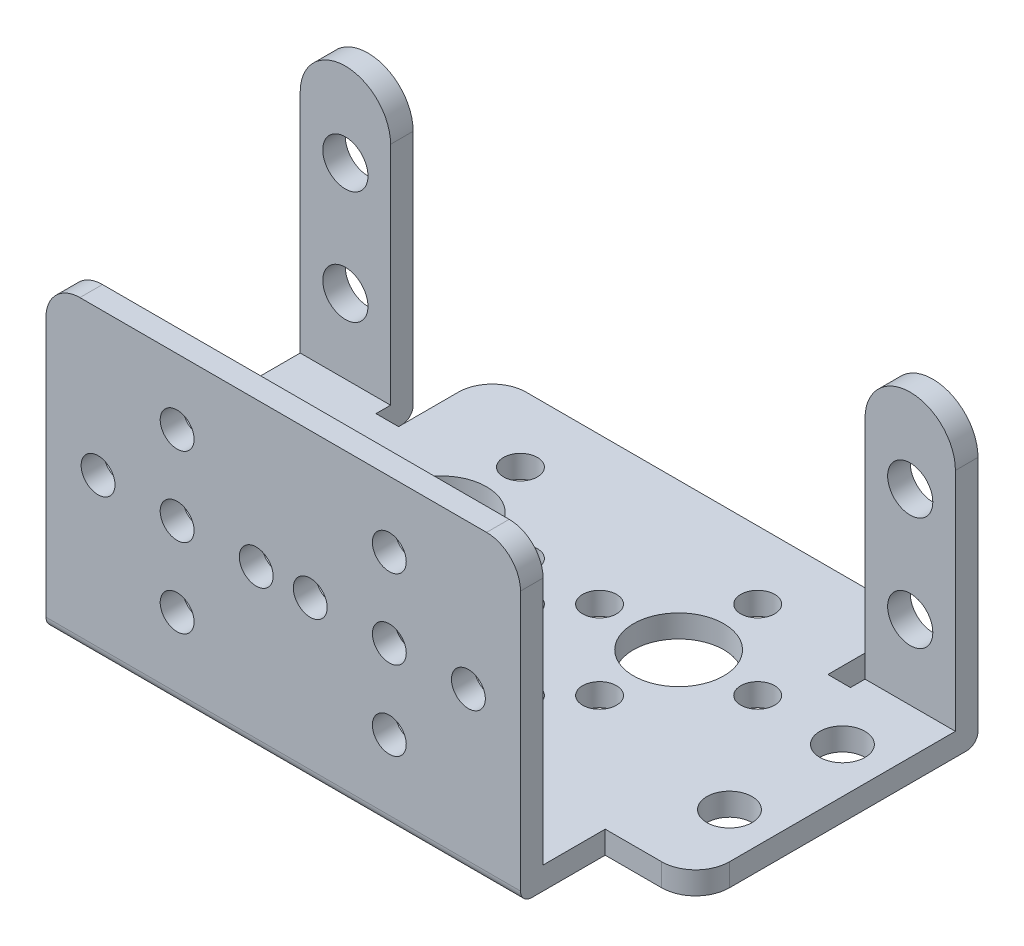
SolidWorks part; units mm, degrees
ref_plane "Front Plane" through (0, 0, 0) normal (0, 0, 1) x (1, 0, 0)
ref_plane "Top Plane" through (0, 0, 0) normal (0, 1, 0) x (1, 0, 0)
ref_plane "Right Plane" through (0, 0, 0) normal (1, 0, 0) x (0, 0, -1)
sketch "Sketch1" plane through (0, 0, 0) normal (0, 1, 0) x (1, 0, 0)
  line L0 (0, 0) -> (0, 35.8825) construction
  line L1 (21, 0) -> (-21, 0)
  line L2 (-21, 0) -> (-21, 7.5)
  line L3 (-21, 7.5) -> (-26, 7.5)
  line L4 (-29, 10.5) -> (-29, 32.5)
  line L5 (-29, 32.5) -> (-21, 32.5)
  line L6 (-21, 32.5) -> (-21, 29.2093)
  line L7 (-21, 29.2093) -> (-19, 29.2093)
  line L8 (-19, 29.2093) -> (-19, 34.5)
  line L9 (-16, 37.5) -> (16, 37.5)
  line L10 (21, 0) -> (21, 7.5)
  line L11 (21, 7.5) -> (26, 7.5)
  line L12 (19, 29.2093) -> (19, 34.5)
  line L13 (21, 29.2093) -> (19, 29.2093)
  line L14 (21, 32.5) -> (21, 29.2093)
  line L15 (29, 32.5) -> (21, 32.5)
  line L16 (29, 10.5) -> (29, 32.5)
  circle A0 centre (-25, 24.5) radius 2
  circle A1 centre (-25, 14.5) radius 2
  circle A2 centre (25, 14.5) radius 2
  circle A3 centre (25, 24.5) radius 2
  arc A4 (19, 34.5) -> (16, 37.5) centre (16, 34.5) ccw
  arc A5 (26, 7.5) -> (29, 10.5) centre (26, 10.5) ccw
  arc A6 (-19, 34.5) -> (-16, 37.5) centre (-16, 34.5) cw
  arc A7 (-26, 7.5) -> (-29, 10.5) centre (-26, 10.5) cw
  circle A8 centre (0, 14) radius 7 construction
  circle A9 centre (0, 14) radius 4
  circle A10 centre (0, 21) radius 1.5
  circle A11 centre (7, 14) radius 1.5
  circle A12 centre (0, 7) radius 1.5
  circle A13 centre (-7, 14) radius 1.5
  circle A14 centre (10.5, 24.5) radius 7 construction
  circle A15 centre (10.5, 24.5) radius 4
  circle A16 centre (10.5, 31.5) radius 1.5
  circle A20 centre (-10.5, 24.5) radius 7 construction
  circle A21 centre (-10.5, 24.5) radius 4
  circle A22 centre (-10.5, 31.5) radius 1.5
  circle A26 centre (3.5, 24.5) radius 1.5
  circle A27 centre (10.5, 17.5) radius 1.5
  circle A28 centre (17.5, 24.5) radius 1.5
  circle A29 centre (-3.5, 24.5) radius 1.5
  circle A30 centre (-10.5, 17.5) radius 1.5
  circle A31 centre (-17.5, 24.5) radius 1.5
  point P13 (0, 37.5)
  point P30 (19, 37.5)
  point P33 (29, 7.5)
  point P36 (-19, 37.5)
  point P39 (-29, 7.5)
  point P56 (4.5151, 24.5)
  point P57 (0, 5.0321)
  point P58 (-7, 14)
  point P76 (-17.5, 24.5)
  point P77 (0, 0)
  dimension "D6" = 4
  dimension "D7" = 4
  dimension "D8" = 10
  dimension "D9" = 14.5
  dimension "D11" = 3
  dimension "D12" = 14
  dimension "D13" = 8
  dimension "D14" = 3
  dimension "D16" = 14
  dimension "D17" = 8
  dimension "D18" = 3
  dimension "D19" = 14
  dimension "D20" = 8
  dimension "D21" = 3
  dimension "D24" = 21
  dimension "D26" = 14
  dimension "D1" = 38
  dimension "D2" = 58
  dimension "D3" = 37.5
  dimension "D4" = 32.5
  dimension "D5" = 2
  dimension "D10" = 7.5
  dimension "D25" = 10.5
  dimension "D15" = 4
  dimension "D22" = 4
  dimension "D23" = 4
extrude "Boss-Extrude1" add sketch "Sketch1" along normal blind 27
sketch "Sketch3" plane through (0, 0, 0) normal (1, 0, 0) x (0, 0, -1)
  line L0 (0, 27) -> (0, 0) construction
  line L1 (2, 28.5272) -> (30.5, 28.5272)
  line L2 (2, 28.5272) -> (2, 2)
  line L3 (2, 2) -> (30.5, 2)
  line L4 (30.5, 28.5272) -> (30.5, 2)
  line L5 (0, 0) -> (7.5, 0) construction
  line L7 (32.557, 2) -> (38.8255, 2)
  line L8 (32.557, 2) -> (32.557, 28.5272)
  line L9 (32.557, 28.5272) -> (38.8255, 28.5272)
  line L10 (38.8255, 2) -> (38.8255, 28.5272)
  dimension "D1" = 28.5
  dimension "D2" = 2
  dimension "D3" = 2
extrude "Cut-Extrude1" cut sketch "Sketch3" against normal through all both and the other way through all
sketch "Sketch4" plane through (0, 0, 0) normal (0, 0, 1) x (1, 0, 0)
  line L0 (-21, 27) -> (-21, 2) construction
  line L1 (-29, 0) -> (-21, 0) construction
  line L2 (-29, 0) -> (-29, 26) construction
  line L3 (-29, 26) -> (-21, 26) construction
  line L4 (-21, 0) -> (-21, 26) construction
  line L5 (0, 0) -> (0, 14.6606) construction
  line L6 (29, 0) -> (21, 0) construction
  line L7 (21, 0) -> (21, 26) construction
  line L8 (29, 0) -> (29, 26) construction
  line L9 (29, 26) -> (21, 26) construction
  line L10 (-29, 22) -> (-29, 28.588)
  line L11 (-29, 28.588) -> (-21, 28.588)
  line L12 (-21, 28.588) -> (-21, 22)
  line L14 (29, 26) -> (21, 26) construction
  line L16 (21, 28.588) -> (21, 22)
  line L17 (29, 28.588) -> (21, 28.588)
  line L18 (29, 22) -> (29, 28.588)
  arc A0 (-21, 22) -> (-29, 22) centre (-25, 22) ccw
  arc A1 (21, 22) -> (29, 22) centre (25, 22) cw
  circle A2 centre (-25, 18.5734) radius 2
  circle A3 centre (-25, 8.5734) radius 2
  circle A4 centre (-9.3912, 14.1874) radius 7 construction
  circle A5 centre (-9.3912, 14.1874) radius 4 construction
  circle A6 centre (-9.3912, 21.1874) radius 1.5
  circle A7 centre (-2.3912, 14.1874) radius 1.5
  circle A8 centre (-9.3912, 7.1874) radius 1.5
  circle A9 centre (-16.3912, 14.1874) radius 1.5
  circle A10 centre (2.3912, 14.1874) radius 1.5
  circle A11 centre (9.3912, 14.1874) radius 7 construction
  circle A12 centre (16.3912, 14.1874) radius 1.5
  circle A13 centre (9.3912, 7.1874) radius 1.5
  circle A14 centre (9.3912, 21.1874) radius 1.5
  circle A15 centre (9.3912, 14.1874) radius 4 construction
  circle A16 centre (25, 8.5734) radius 2
  circle A17 centre (25, 18.5734) radius 2
  circle A18 centre (-9.3912, 14.1874) radius 1.5
  circle A19 centre (9.3912, 14.1874) radius 1.5
  dimension "D2" = 4
  dimension "D3" = 4
  dimension "D4" = 10
  dimension "D5" = 14
  dimension "D6" = 4
  dimension "D7" = 3
  dimension "D8" = 3
  dimension "D1" = 26
extrude "Cut-Extrude2" cut sketch "Sketch4" against normal through all
sketch "Sketch5" plane through (0, 0, -32.557) normal (0, 0, -1) x (-1, 0, 0)
  line L1 (-19, 2) -> (19, 2)
  line L2 (-19, 2) -> (-19, 29.0641)
  line L3 (-19, 29.0641) -> (19, 29.0641)
  line L4 (19, 2) -> (19, 29.0641)
extrude "Cut-Extrude3" cut sketch "Sketch5" against normal blind 27
fillet "Fillet1" radius 3 2 edges at (21, 27, -1) (-21, 27, -1)
fillet "Fillet2" radius 1 3 edges at (-25, 0, -32.5) (25, 0, -32.5) (0, 0, 0)
